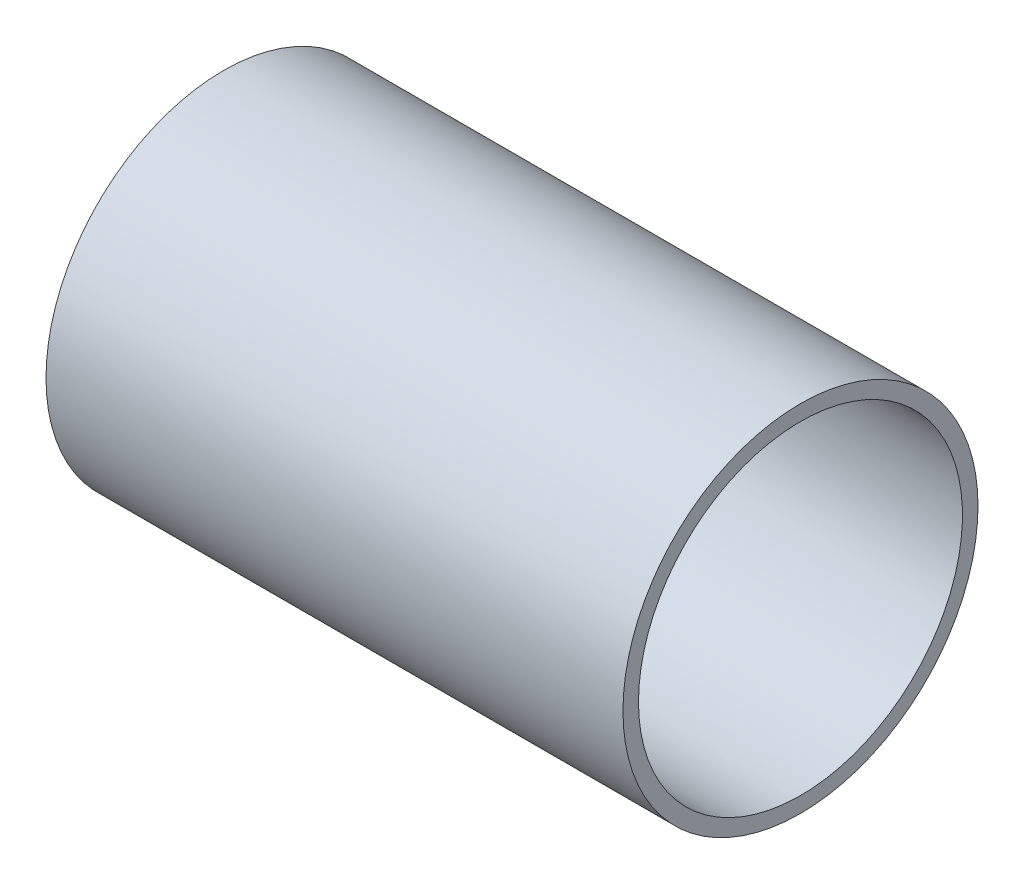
SolidWorks part; units mm, degrees
ref_plane "Plan1" through (0, 0, 0) normal (0, 0, 1) x (1, 0, 0)
ref_plane "Plan2" through (0, 0, 0) normal (0, 1, 0) x (1, 0, 0)
ref_plane "Plan3" through (0, 0, 0) normal (1, 0, 0) x (0, 0, -1)
sketch "Esquisse1" plane through (0, 0, 0) normal (0, 0, 1) x (1, 0, 0)
  line L0 (-22, 3.65) -> (5, 3.65) construction
  line L1 (0, 0) -> (-13, 0)
  line L2 (0, 0) -> (0, -0.35)
  line L3 (0, -0.35) -> (-13, -0.35)
  line L4 (-13, 0) -> (-13, -0.35)
  dimension "D1" = 13
  dimension "D2" = 0.35
  dimension "D3" = 3.65
revolve "Base-Révolution" add sketch "Esquisse1" angle 360 about L0
